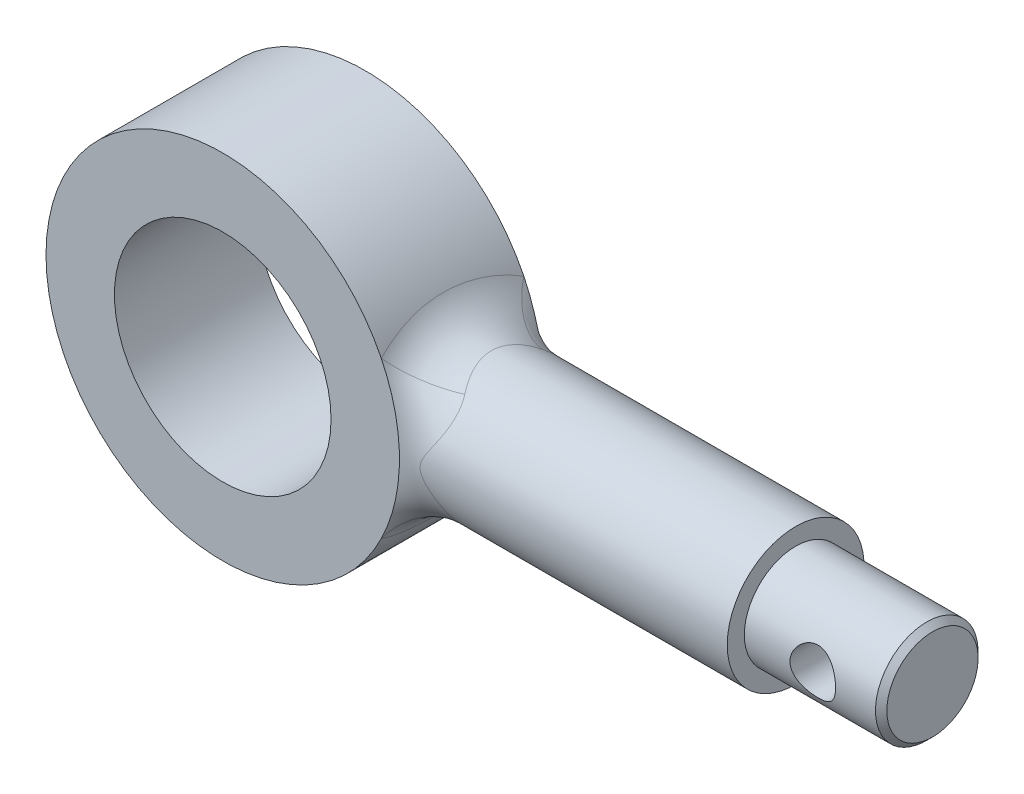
SolidWorks part; units mm, degrees
ref_plane "Plan1" through (0, 0, 0) normal (0, 0, 1) x (1, 0, 0)
ref_plane "Plan2" through (0, 0, 0) normal (0, 1, 0) x (1, 0, 0)
ref_plane "Plan3" through (0, 0, 0) normal (1, 0, 0) x (0, 0, -1)
sketch "Esquisse1" plane through (0, 0, 0) normal (0, 0, 1) x (1, 0, 0)
  circle A0 centre (0, 0) radius 31
  circle A1 centre (0, 0) radius 19
  dimension "D1" = 62
  dimension "D2" = 38
extrude "Extrusion1" add sketch "Esquisse1" along normal mid plane 25
sketch "Esquisse2" plane through (0, 0, 0) normal (0, 0, 1) x (1, 0, 0)
  line L0 (0, 0) -> (132.3103, 0) construction
  line L2 (25.1848, 0) -> (83.3386, 0)
  line L3 (25.1848, 0) -> (25.1848, 12)
  line L4 (25.1848, 12) -> (88, 12)
  line L5 (88, 9) -> (88, 12)
  line L6 (88, 9) -> (112, 9)
  line L8 (83.3386, 0) -> (112, 0)
  line L9 (112, 9) -> (112, 0)
  dimension "D1" = 24
  dimension "D2" = 18
  dimension "D3" = 88
  dimension "D4" = 24
revolve "Révolution1" add sketch "Esquisse2" angle 360 about L0
sketch "Esquisse3" plane through (0, 0, 0) normal (0, 0, 1) x (1, 0, 0)
  line L0 (0, 0) -> (141.6838, 0) construction
  line L1 (88, -12) -> (88, 12) construction
  circle A1 centre (100, 0) radius 4
  dimension "D2" = 8
  dimension "D4" = 12
extrude "Enlèv. mat.-Extru.1" cut sketch "Esquisse3" against normal mid plane 35
fillet "Congé1" radius 10 1 edges at (30.9476, 1.8014, -11.864)
ref_plane "Plan4" through (0, 0, 0) normal (0, 0, 1) x (1, 0, 0)
chamfer "Chanfrein1" distance 1 angle 45 1 edges at (112, 0, 9)
